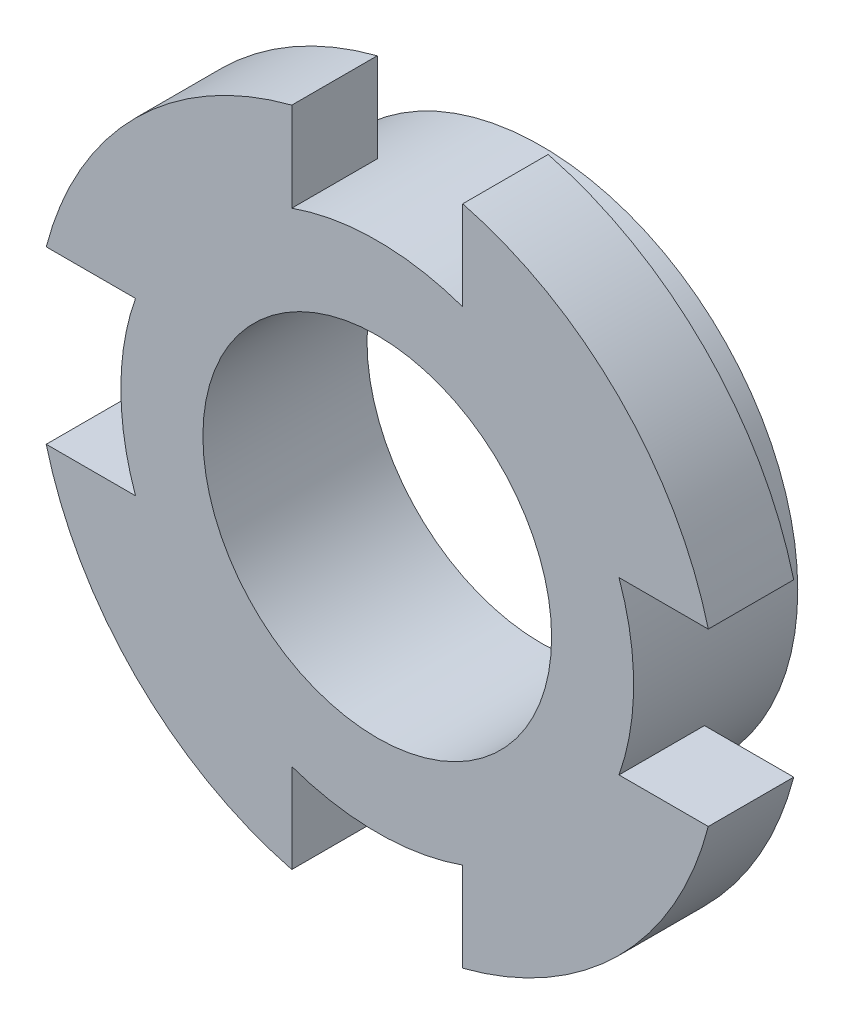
SolidWorks part; units mm, degrees
ref_plane "Plane1" through (0, 0, 0) normal (0, 0, 1) x (1, 0, 0)
ref_plane "Plane2" through (0, 0, 0) normal (0, 1, 0) x (1, 0, 0)
ref_plane "Plane3" through (0, 0, 0) normal (1, 0, 0) x (0, 0, -1)
sketch "Sketch1" plane through (0, 0, 0) normal (0, 0, 1) x (1, 0, 0)
  circle A0 centre (0, 0) radius 4.7625
  dimension "D2" = 9.525
extrude "Base-Extrude" add sketch "Sketch1" along normal blind 11.1125
sketch "Sketch2" plane through (0, 0, 11.1125) normal (0, 0, 1) x (1, 0, 0)
  circle A0 centre (0, 0) radius 6.35
  dimension "D1" = 12.7
extrude "Boss-Extrude1" add sketch "Sketch2" along normal blind 1.5875
sketch "Sketch3" plane through (0, 0, 12.7) normal (0, 0, 1) x (1, 0, 0)
  circle A0 centre (0, 0) radius 3.2385
  dimension "D1" = 6.477
extrude "Cut-Extrude2" cut sketch "Sketch3" against normal through all
sketch "Sketch4" plane through (0, 0, 0) normal (0, 0, -1) x (-1, 0, 0)
  circle A0 centre (0, 0) radius 6.7889
extrude "Cut-Extrude3" cut sketch "Sketch4" against normal blind 9.652
sketch "Sketch5" plane through (0, 0, 9.652) normal (0, 0, -1) x (-1, 0, 0)
  line L0 (1.5875, 6.4879) -> (1.5875, 4.4901)
  line L1 (-1.5875, 6.4879) -> (-1.5875, 4.4901)
  line L2 (0, 0) -> (0, 7.0396) construction
  line L3 (0, 0) -> (7.6164, 0) construction
  line L4 (-6.4879, 1.5875) -> (-4.4901, 1.5875)
  line L5 (-6.4879, -1.5875) -> (-4.4901, -1.5875)
  line L6 (4.4901, 1.5875) -> (6.4879, 1.5875)
  line L7 (1.5875, -4.4901) -> (1.5875, -6.4879)
  line L8 (-1.5875, -4.4901) -> (-1.5875, -6.4879)
  line L9 (4.4901, -1.5875) -> (6.4879, -1.5875)
  arc A0 (-4.4901, 1.5875) -> (-4.4901, -1.5875) centre (0, 0) ccw
  arc A1 (6.4879, 1.5875) -> (1.5875, 6.4879) centre (0, 0) ccw
  arc A2 (-1.5875, -4.4901) -> (1.5875, -4.4901) centre (0, 0) ccw
  arc A3 (4.4901, -1.5875) -> (4.4901, 1.5875) centre (0, 0) ccw
  arc A4 (1.5875, 4.4901) -> (-1.5875, 4.4901) centre (0, 0) ccw
  circle A5 centre (0, 0) radius 7.6222
  arc A6 (-1.5875, 6.4879) -> (-6.4879, 1.5875) centre (0, 0) ccw
  arc A7 (-6.4879, -1.5875) -> (-1.5875, -6.4879) centre (0, 0) ccw
  arc A8 (1.5875, -6.4879) -> (6.4879, -1.5875) centre (0, 0) ccw
  dimension "D1" = 1.5875
  dimension "D2" = 1.5875
  dimension "D3" = 3.175
  dimension "D4" = 3.175
extrude "Cut-Extrude4" cut sketch "Sketch5" against normal through all
